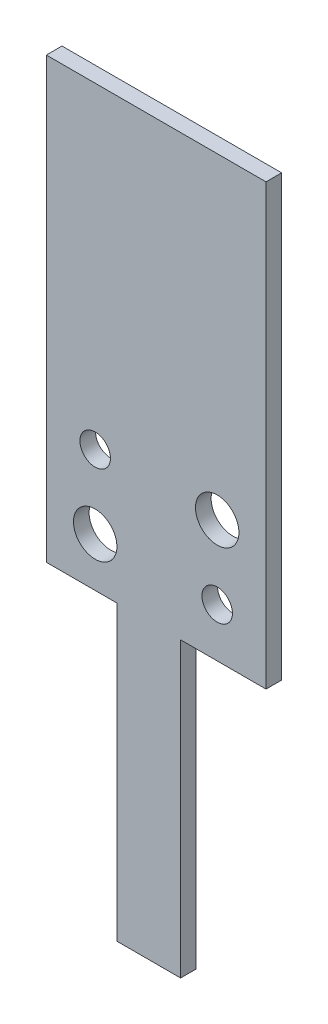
SolidWorks part; units mm, degrees
ref_plane "Front" through (0, 0, 0) normal (0, 0, 1) x (1, 0, 0)
ref_plane "Top" through (0, 0, 0) normal (0, 1, 0) x (1, 0, 0)
ref_plane "center" through (0, 0, 0) normal (1, 0, 0) x (0, 0, -1)
sketch "Sketch1" plane through (0, 0, 0) normal (0, 0, 1) x (1, 0, 0)
  line L1 (-5.334, 35.56) -> (6.096, 35.56)
  line L2 (-5.334, 35.56) -> (-5.334, -2.54)
  line L3 (-5.334, -2.54) -> (6.096, -2.54)
  line L4 (6.096, 35.56) -> (6.096, -2.54)
  dimension "D1" = 11.43
  dimension "D2" = 38.1
  dimension "D3" = 6.096
  dimension "D4" = 2.54
extrude "Extrude1" add sketch "Sketch1" along normal blind 0.8128
sketch "Sketch2" plane through (0, 0, 0.8128) normal (0, 0, 1) x (1, 0, 0)
  line L0 (-5.334, -2.54) -> (6.096, -2.54) construction
  line L1 (-5.334, -2.54) -> (-1.651, -2.54)
  line L2 (-5.334, -2.54) -> (-5.334, 12.7)
  line L3 (-5.334, 12.7) -> (-1.651, 12.7)
  line L4 (-1.651, -2.54) -> (-1.651, 12.7)
  line L6 (-5.334, 35.56) -> (-5.334, -2.54) construction
  dimension "D1" = 1.651
  dimension "D2" = 12.7
extrude "Cut-Extrude1" cut sketch "Sketch2" against normal through all
sketch "Sketch3" plane through (0, 0, 0.8128) normal (0, 0, 1) x (1, 0, 0)
  line L0 (-1.651, 12.7) -> (-5.334, 12.7) construction
  line L1 (6.096, -2.54) -> (1.651, -2.54)
  line L2 (6.096, -2.54) -> (6.096, 12.7)
  line L3 (6.096, 12.7) -> (1.651, 12.7)
  line L4 (1.651, -2.54) -> (1.651, 12.7)
  line L5 (-1.651, -2.54) -> (-1.651, 12.7) construction
  dimension "D1" = 3.302
extrude "Cut-Extrude2" cut sketch "Sketch3" against normal through all
hole_wizard "#43 (0.089000) Diameter Hole1" positions "Sketch5" profile "Sketch4" hole size "#43" standard "Ansi Inch"
sketch "Sketch5" plane through (0, 0, 0.8128) normal (0, 0, 1) x (1, 0, 0)
  line L0 (6.096, 12.7) -> (6.096, 35.56) construction
  line L1 (1.778, 21.59) -> (6.096, 21.59) construction
  line L2 (-5.334, 35.56) -> (-5.334, 12.7) construction
  line L3 (-1.651, 12.7) -> (-5.334, 12.7) construction
  point P0 (-2.794, 15.24)
  point P1 (3.556, 19.05)
  dimension "D1" = 2.54
  dimension "D2" = 2.54
  dimension "D3" = 2.54
  dimension "D4" = 2.54
sketch "Sketch4" plane through (-2.794, 15.24, 0.8128) normal (1, 0, 0) x (0, -1, 0)
  line L0 (0, 0) -> (0, 0.8128)
  line L1 (0, 0.8128) -> (1.1303, 0.8128)
  line L2 (1.1303, 0.8128) -> (1.1303, 0)
  line L5 (1.1303, 0) -> (0, 0)
  line L11 (0, -6.35) -> (0, 107.95) construction
  dimension "Thru Hole Dia." = 2.2606
  dimension "Thru Hole Depth" = 0.8128
hole_wizard "1/16 (0.062500) Diameter Hole1" positions "Sketch7" profile "Sketch6" hole size "1/16" standard "Ansi Inch"
sketch "Sketch7" plane through (0, 0, 0.8128) normal (0, 0, 1) x (1, 0, 0)
  line L1 (3.556, 19.05) -> (-2.794, 19.05) construction
  line L2 (3.556, 19.05) -> (3.556, 15.24) construction
  line L3 (3.556, 15.24) -> (-2.794, 15.24) construction
  line L4 (-2.794, 19.05) -> (-2.794, 15.24) construction
  circle A0 centre (3.556, 19.05) radius 1.1303 construction
  circle A1 centre (-2.794, 15.24) radius 1.1303 construction
  point P0 (-2.794, 19.05)
  point P1 (3.556, 15.24)
sketch "Sketch6" plane through (-2.794, 19.05, 0.8128) normal (1, 0, 0) x (0, -1, 0)
  line L0 (0, 0) -> (0, 0.8128)
  line L1 (0, 0.8128) -> (0.7937, 0.8128)
  line L2 (0.7937, 0.8128) -> (0.7937, 0)
  line L5 (0.7937, 0) -> (0, 0)
  line L11 (0, -6.35) -> (0, 107.95) construction
  dimension "Thru Hole Dia." = 1.5875
  dimension "Thru Hole Depth" = 0.8128
